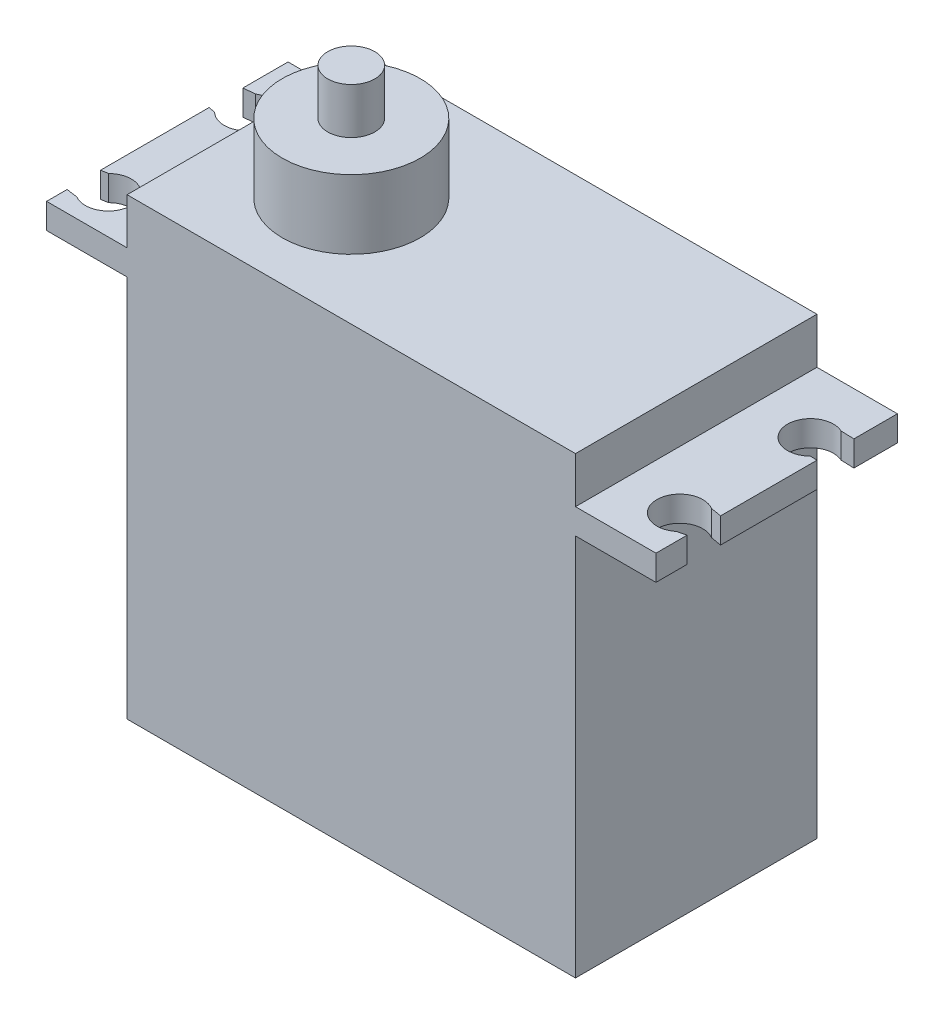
SolidWorks part; units mm, degrees
ref_plane "Front Plane" through (0, 0, 0) normal (0, 0, 1) x (1, 0, 0)
ref_plane "Top Plane" through (0, 0, 0) normal (0, 1, 0) x (1, 0, 0)
ref_plane "Right Plane" through (0, 0, 0) normal (1, 0, 0) x (0, 0, -1)
sketch "Sketch1" plane through (0, 0, 0) normal (0, 1, 0) x (1, 0, 0)
  line L1 (-15.1804, 12.5459) -> (23.8196, 12.5459)
  line L2 (-15.1804, 12.5459) -> (-15.1804, -8.4541)
  line L3 (-15.1804, -8.4541) -> (23.8196, -8.4541)
  line L4 (23.8196, 12.5459) -> (23.8196, -8.4541)
  dimension "D1" = 39
  dimension "D2" = 21
extrude "Boss-Extrude1" add sketch "Sketch1" along normal blind 39.5
sketch "Sketch2" plane through (23.8196, 0, 0) normal (1, 0, 0) x (0, 0, -1)
  line L0 (-8.4541, 39.5) -> (-8.4541, 0) construction
  line L1 (-8.4541, 35.5) -> (12.5459, 35.5)
  line L2 (-8.4541, 35.5) -> (-8.4541, 33.3)
  line L3 (-8.4541, 33.3) -> (12.5459, 33.3)
  line L4 (12.5459, 35.5) -> (12.5459, 33.3)
  line L5 (12.5459, 39.5) -> (12.5459, 0) construction
  line L6 (-8.4541, 39.5) -> (12.5459, 39.5) construction
  dimension "D1" = 4
  dimension "D2" = 2.2
extrude "Boss-Extrude2" add sketch "Sketch2" along normal blind 7 and the other way blind 46
sketch "Sketch3" plane through (0, 35.5, 0) normal (0, 1, 0) x (1, 0, 0)
  line L0 (23.8196, -8.4541) -> (23.8196, 12.5459) construction
  line L1 (-15.1804, 12.5459) -> (-15.1804, -8.4541) construction
  line L2 (30.2197, 5.5607) -> (32.2297, 5.5607)
  line L3 (32.2297, 5.5607) -> (32.2297, 8.7142)
  line L4 (32.2297, 8.7142) -> (29.6675, 8.8004)
  line L5 (32.8585, -3.1959) -> (29.8543, -2.6659)
  line L6 (32.8585, -3.1959) -> (32.8585, -5.2088)
  line L7 (32.8585, -5.2088) -> (30.0828, -5.928)
  line L8 (-25.6091, 8.3083) -> (-25.6091, 6.4028)
  line L9 (-25.6091, 6.4028) -> (-21.5804, 5.5607)
  line L10 (-25.6091, 8.3083) -> (-21.192, 8.7142)
  line L11 (-21.5804, -3.6556) -> (-25.6091, -4.3774)
  line L12 (-25.6091, -4.3774) -> (-25.6091, -6.1712)
  line L13 (-25.6091, -6.1712) -> (-21.192, -6.8091)
  arc A0 (29.6675, 8.8004) -> (30.2197, 5.5607) centre (28.8196, 6.989) ccw
  arc A1 (29.8543, -2.6659) -> (30.0828, -5.928) centre (28.8196, -4.3774) ccw
  arc A2 (-21.5804, 5.5607) -> (-21.192, 8.7142) centre (-20.1804, 6.989) ccw
  arc A3 (-21.192, -6.8091) -> (-21.5804, -3.6556) centre (-20.1804, -5.0838) ccw
  dimension "D3" = 4
  dimension "D1" = 5
  dimension "D2" = 5
extrude "Cut-Extrude3" cut sketch "Sketch3" against normal blind 7
sketch "Sketch5" plane through (0, 39.5, 0) normal (0, 1, 0) x (1, 0, 0)
  line L0 (-15.1804, -8.4541) -> (23.8196, -8.4541) construction
  line L1 (-15.1804, 12.5459) -> (-15.1804, -8.4541) construction
  circle A0 centre (-5.1804, 1.0459) radius 2.0513
  dimension "D1" = 9.5
  dimension "D2" = 10
extrude "Boss-Extrude4" add sketch "Sketch5" along normal blind 10
sketch "Sketch4" plane through (0, 39.5, 0) normal (0, 1, 0) x (1, 0, 0)
  circle A0 centre (-5.1804, 1.0459) radius 6
  point P2 (-5.1804, 1.0459)
  dimension "D1" = 12
extrude "Boss-Extrude5" add sketch "Sketch4" along normal blind 6
